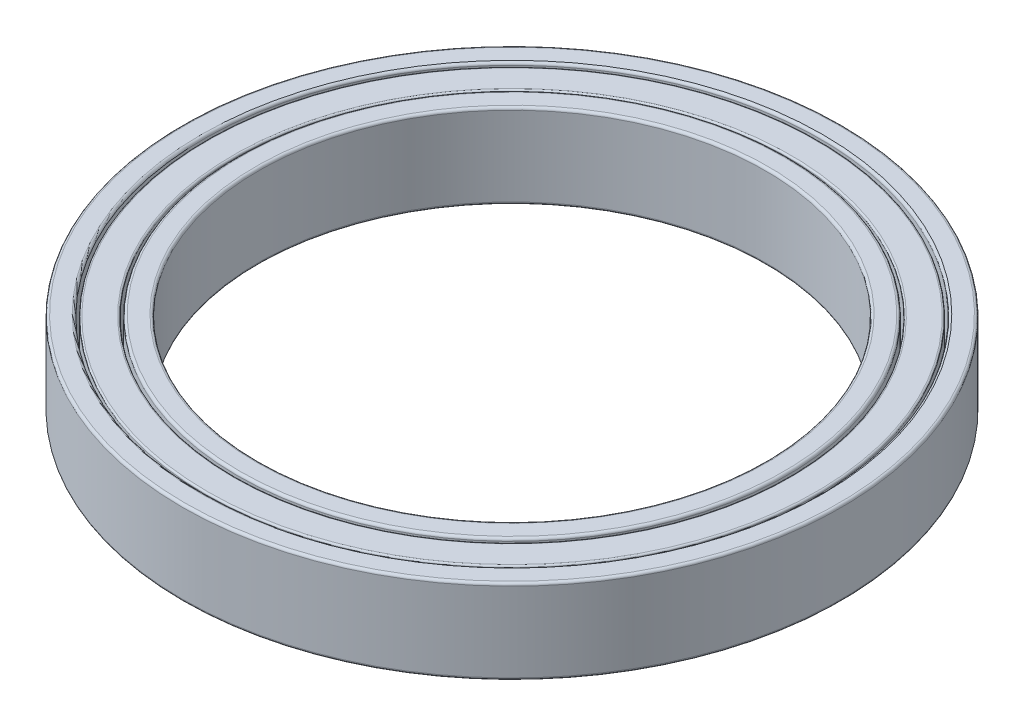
SolidWorks part; units mm, degrees
ref_plane "Front Plane" through (0, 0, 0) normal (0, 0, 1) x (1, 0, 0)
ref_plane "Top Plane" through (0, 0, 0) normal (0, 1, 0) x (1, 0, 0)
ref_plane "Right Plane" through (0, 0, 0) normal (1, 0, 0) x (0, 0, -1)
sketch "Sketch1" plane through (0, 0, 0) normal (0, 1, 0) x (1, 0, 0)
  circle A0 centre (0, 0) radius 30
  circle A1 centre (0, 0) radius 39 construction
  circle A2 centre (0, 0) radius 36.5 construction
  circle A3 centre (0, 0) radius 32.5
  dimension "D1" = 60
  dimension "D2" = 78
  dimension "D3" = 2.5
  dimension "D4" = 2.5
extrude "Boss-Extrude1" add sketch "Sketch1" along normal blind 10
sketch "Sketch2" plane through (0, 0, 0) normal (0, 1, 0) x (1, 0, 0)
  circle A0 centre (0, 0) radius 39 construction
  circle A1 centre (0, 0) radius 36.5 construction
  circle A2 centre (0, 0) radius 39
  circle A3 centre (0, 0) radius 36.5
extrude "Boss-Extrude2" add sketch "Sketch2" along normal up to surface (10 mm away) separate body
sketch "Sketch3" plane through (0, 10, 0) normal (0, 1, 0) x (1, 0, 0)
  circle A4 centre (0, 0) radius 32.8
  circle A5 centre (0, 0) radius 32.8
  circle A7 centre (0, 0) radius 36.2
  circle A8 centre (0, 0) radius 36.2
  dimension "D1" = 0.3
  dimension "D2" = 0.3
extrude "Boss-Extrude3" add sketch "Sketch3" against normal offset from surface (9.6 mm away) 0.2 from offset 0.2 separate body
fillet "Fillet1" radius 0.3 4 edges at (0, 0, 39) (0, 10, 39) (0, 0, 36.5) (0, 10, 36.5)
fillet "Fillet2" radius 0.3 4 edges at (0, 0, 30) (0, 0, 32.5) (0, 10, 30) (0, 10, 32.5)
fillet "Fillet3" radius 0.2 4 edges at (0, 0.2, 32.8) (0, 0.2, 36.2) (0, 9.8, 36.2) (0, 9.8, 32.8)
